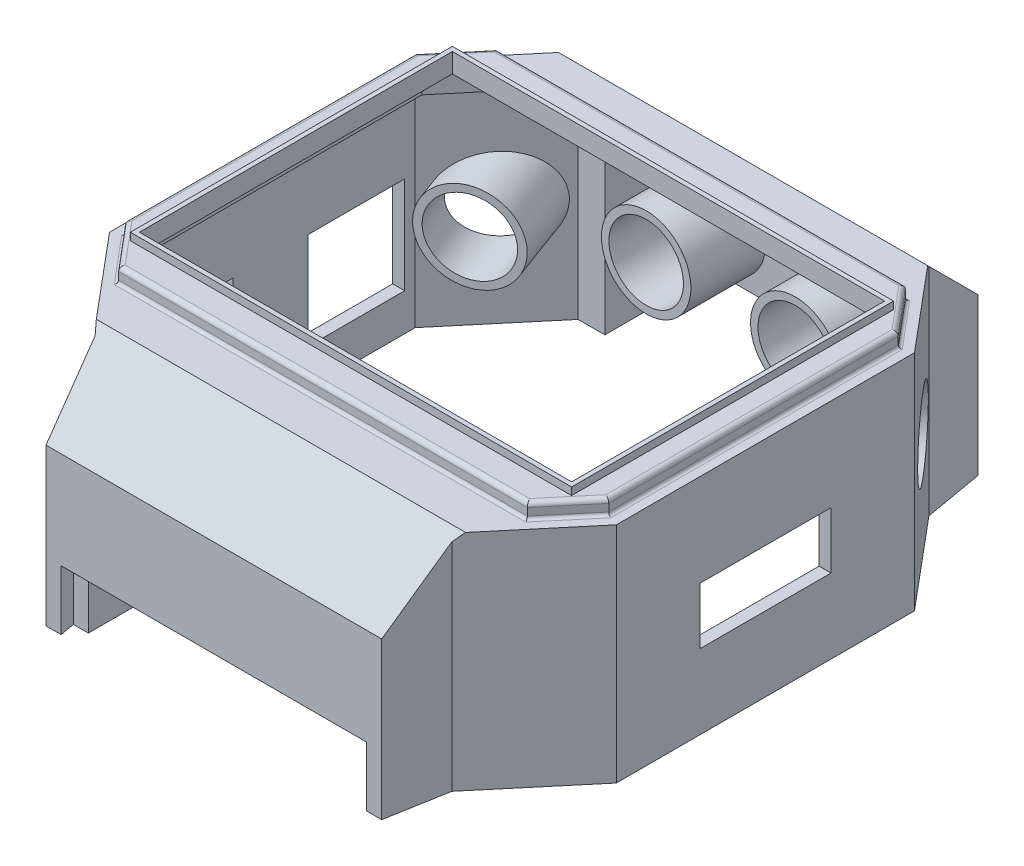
SolidWorks part; units mm, degrees
ref_plane "前视基准面" through (0, 0, 0) normal (0, 0, 1) x (1, 0, 0)
ref_plane "上视基准面" through (0, 0, 0) normal (0, 1, 0) x (1, 0, 0)
ref_plane "右视基准面" through (0, 0, 0) normal (1, 0, 0) x (0, 0, -1)
sketch "草图1" plane through (0, 0, 0) normal (0, 1, 0) x (1, 0, 0)
  line L0 (-11.2601, 20) -> (-11.9654, 16)
  line L1 (-11.2601, 20) -> (11.2601, 20)
  line L2 (-17, 10) -> (-17, -10)
  line L3 (-11.2601, -20) -> (11.2601, -20)
  line L4 (17, 10) -> (17, -10)
  line L5 (-12.7774, 15.0323) -> (12.7774, -15.0323) construction
  line L6 (-12.7774, -15.0323) -> (12.7774, 15.0323) construction
  line L7 (-11.9654, 16) -> (-17, 10)
  line L8 (11.2601, 20) -> (11.9654, 16)
  line L9 (11.9654, 16) -> (17, 10)
  line L10 (11.2601, -20) -> (11.9654, -16)
  line L11 (11.9654, -16) -> (17, -10)
  line L12 (-11.2601, -20) -> (-11.9654, -16)
  line L13 (-11.9654, -16) -> (-17, -10)
  point P0 (0, 0)
  dimension "D2" = 20
  dimension "D3" = 80
  dimension "D4" = 80
  dimension "D5" = 80
  dimension "D6" = 80
  dimension "D7" = 130
  dimension "D8" = 130
  dimension "D9" = 130
  dimension "D10" = 130
  dimension "D11" = 4
  dimension "D12" = 6
  dimension "D13" = 4
  dimension "D14" = 6
  dimension "D15" = 4
  dimension "D16" = 6
  dimension "D17" = 4
  dimension "D18" = 6
  dimension "D19" = 22.5202
extrude "凸台-拉伸1" add sketch "草图1" along normal blind 17
sketch "草图2" plane through (0, 17, 0) normal (0, 1, 0) x (1, 0, 0)
  line L1 (-14.5, 10.5) -> (14.5, 10.5)
  line L2 (-14.5, 10.5) -> (-14.5, -10.5)
  line L3 (-14.5, -10.5) -> (14.5, -10.5)
  line L4 (14.5, 10.5) -> (14.5, -10.5)
  line L7 (-14.5, 10.5) -> (14.5, -10.5) construction
  line L8 (-14.5, -10.5) -> (14.5, 10.5) construction
  point P0 (0, 0)
  dimension "D1" = 29
  dimension "D2" = 21
sketch "草图3" plane through (0, 17, 0) normal (0, 1, 0) x (1, 0, 0)
  line L0 (-11.2601, 20) -> (11.2601, 20)
  line L1 (11.2601, 20) -> (11.9654, 16)
  line L2 (11.9654, 16) -> (17, 10)
  line L3 (17, 10) -> (17, -10)
  line L4 (17, -10) -> (11.9654, -16)
  line L5 (11.9654, -16) -> (11.2601, -20)
  line L6 (11.2601, -20) -> (-11.2601, -20)
  line L7 (-11.2601, -20) -> (-11.9654, -16)
  line L8 (-11.9654, -16) -> (-17, -10)
  line L9 (-17, -10) -> (-17, 10)
  line L10 (-17, 10) -> (-11.9654, 16)
  line L11 (-11.9654, 16) -> (-11.2601, 20)
  line L12 (-14.5, 10.5) -> (14.5, 10.5) construction
  line L13 (14.5, 10.5) -> (14.5, -10.5) construction
  line L14 (14.5, -10.5) -> (-14.5, -10.5) construction
  line L15 (-14.5, -10.5) -> (-14.5, 10.5) construction
  line L16 (-14.8, 10.8) -> (14.8, 10.8)
  line L17 (14.8, 10.8) -> (14.8, -10.8)
  line L18 (14.8, -10.8) -> (-14.8, -10.8)
  line L19 (-14.8, -10.8) -> (-14.8, 10.8)
  dimension "D1" = 0.3
extrude "切除-拉伸3" cut sketch "草图3" against normal blind 1
sketch "草图5" plane through (0, 16, 0) normal (0, 1, 0) x (1, 0, 0)
  line L0 (-11.2601, 20) -> (11.2601, 20)
  line L1 (11.2601, 20) -> (11.9654, 16)
  line L2 (11.9654, 16) -> (17, 10)
  line L3 (17, 10) -> (17, -10)
  line L4 (17, -10) -> (11.9654, -16)
  line L5 (11.9654, -16) -> (11.2601, -20)
  line L6 (11.2601, -20) -> (-11.2601, -20)
  line L7 (-11.2601, -20) -> (-11.9654, -16)
  line L8 (-11.9654, -16) -> (-17, -10)
  line L9 (-17, -10) -> (-17, 10)
  line L10 (-17, 10) -> (-11.9654, 16)
  line L11 (-11.9654, 16) -> (-11.2601, 20)
  line L12 (11.2148, 15.65) -> (16.2, 9.7088) construction
  line L14 (13.7074, 12.6794) -> (16.2, 9.7088)
  line L15 (16.2, 9.7088) -> (16.2, -9.7088)
  line L16 (16.2, -9.7088) -> (13.7074, -12.6794)
  line L17 (16.2, -9.7088) -> (11.2148, -15.65) construction
  line L18 (11.2148, -15.65) -> (10.5888, -19.2) construction
  line L19 (-11.2148, 15.65) -> (-10.5888, 19.2) construction
  line L20 (-13.7074, -12.6794) -> (-16.2, -9.7088)
  line L21 (-16.2, -9.7088) -> (-16.2, 9.7088)
  line L22 (-16.2, 9.7088) -> (-13.7074, 12.6794)
  line L24 (-13.7074, -12.6794) -> (13.7074, -12.6794)
  line L25 (-13.7074, 12.6794) -> (13.7074, 12.6794)
  line L26 (-11.2148, -15.65) -> (-16.2, -9.7088) construction
  line L27 (-10.5888, -19.2) -> (-11.2148, -15.65) construction
  line L28 (10.5888, -19.2) -> (-10.5888, -19.2) construction
  line L29 (-16.2, 9.7088) -> (-11.2148, 15.65) construction
  line L30 (-10.5888, 19.2) -> (10.5888, 19.2) construction
  line L31 (10.5888, 19.2) -> (11.2148, 15.65) construction
  dimension "D1" = 0.8
extrude "切除-拉伸4" cut sketch "草图5" against normal blind 1
fillet "圆角5" radius 0.3 8 edges at (-14.9537, 16, 11.1941) (-16.2, 16, 0) (-14.9537, 16, -11.1941) (0, 16, -12.6794) (14.9537, 16, -11.1941) (16.2, 16, 0) (14.9537, 16, 11.1941) (0, 16, 12.6794)
fillet "圆角6" radius 0.2 8 edges at (-14.9537, 15, 11.1941) (-16.2, 15, 0) (-14.9537, 15, -11.1941) (0, 15, -12.6794) (14.9537, 15, -11.1941) (16.2, 15, 0) (14.9537, 15, 11.1941) (0, 15, 12.6794)
sketch "草图6" plane through (17, 0, 0) normal (1, 0, 0) x (0, 0, -1)
  line L0 (-15.5, 15) -> (-20, 10.5)
  line L3 (15.5, 15) -> (20, 10.5)
  line L6 (-16, 15) -> (-10, 15) construction
  line L7 (-20, 15) -> (-20, 0) construction
  line L8 (10, 15) -> (16, 15) construction
  line L9 (20, 15) -> (20, 0) construction
  line L10 (-15.5, 15) -> (-20, 15)
  line L11 (-20, 15) -> (-20, 10.5)
  line L12 (20, 10.5) -> (20, 15)
  line L13 (20, 15) -> (15.5, 15)
  point P13 (13, 15)
  point P14 (-13, 15)
  dimension "D1" = 2.5
  dimension "D2" = 45
  dimension "D3" = 45
  dimension "D4" = 2.5
extrude "切除-拉伸5" cut sketch "草图6" against normal up to next
sketch "草图7" plane through (0, 17, 0) normal (0, 1, 0) x (1, 0, 0)
  line L0 (-14.5, 10.5) -> (14.5, 10.5) construction
  line L1 (-14.5, 10.5) -> (-14.5, -10.5) construction
  line L2 (-14.5, -10.5) -> (14.5, -10.5) construction
  line L3 (14.5, 10.5) -> (14.5, -10.5) construction
  line L4 (-14.5, 10.5) -> (14.5, 10.5)
  line L5 (-14.5, 10.5) -> (-14.5, -10.5)
  line L6 (-14.5, -10.5) -> (14.5, -10.5)
  line L7 (14.5, 10.5) -> (14.5, -10.5)
extrude "切除-拉伸6" cut sketch "草图7" against normal up to next
sketch "草图8" plane through (0, 0, 0) normal (0, -1, 0) x (1, 0, 0)
  line L78 (10.9524, -17.138) -> (-10.9524, -17.138)
  line L79 (10.9691, 17.0434) -> (-10.9691, 17.0434)
  line L90 (10.5888, -19.2) -> (11.2148, -15.65)
  line L91 (11.2148, -15.65) -> (16.2, -9.7088)
  line L92 (16.2, -9.7088) -> (16.2, 9.7088)
  line L93 (16.2, 9.7088) -> (11.2148, 15.65)
  line L94 (11.2148, 15.65) -> (10.5888, 19.2)
  line L95 (10.5888, 19.2) -> (-10.5888, 19.2)
  line L96 (-10.5888, 19.2) -> (-11.2148, 15.65)
  line L97 (-11.2148, 15.65) -> (-16.2, 9.7088)
  line L98 (-16.2, 9.7088) -> (-16.2, -9.7088)
  line L99 (-16.2, -9.7088) -> (-11.2148, -15.65)
  line L100 (-11.2148, -15.65) -> (-10.5888, -19.2)
  line L101 (-10.5888, -19.2) -> (10.5888, -19.2)
  line L102 (10.9524, -17.138) -> (11.2148, -15.65)
  line L103 (11.2148, -15.65) -> (16.2, -9.7088)
  line L104 (16.2, -9.7088) -> (16.2, 9.7088)
  line L105 (16.2, 9.7088) -> (11.2148, 15.65)
  line L106 (11.2148, 15.65) -> (10.9691, 17.0434)
  line L108 (-10.9691, 17.0434) -> (-11.2148, 15.65)
  line L109 (-11.2148, 15.65) -> (-16.2, 9.7088)
  line L110 (-16.2, 9.7088) -> (-16.2, -9.7088)
  line L111 (-16.2, -9.7088) -> (-11.2148, -15.65)
  line L112 (-11.2148, -15.65) -> (-10.9524, -17.138)
  dimension "D1" = 0.8
extrude "切除-拉伸7" cut sketch "草图8" against normal offset from surface (12.5 mm away) 2.5
sketch "草图9" plane through (0, 12.5, 0) normal (0, -1, 0) x (1, 0, 0)
  line L0 (-12.385, 15.5) -> (12.385, 15.5) construction
  line L1 (-11.2148, 15.65) -> (-16.2, 9.7088) construction
  line L2 (11.2148, 15.65) -> (16.2, 9.7088) construction
  line L3 (16.2, 9.7088) -> (16.2, -9.7088) construction
  line L4 (-12.385, -15.5) -> (12.385, -15.5) construction
  line L5 (16.2, -9.7088) -> (11.2148, -15.65) construction
  line L6 (-11.2148, -15.65) -> (-16.2, -9.7088) construction
  line L7 (-11.2412, 15.5) -> (11.2412, 15.5)
  line L8 (-11.2148, 15.65) -> (-16.2, 9.7088)
  line L9 (11.2148, 15.65) -> (16.2, 9.7088)
  line L10 (16.2, 9.7088) -> (16.2, -9.7088)
  line L11 (-11.2412, -15.5) -> (11.2412, -15.5)
  line L12 (16.2, -9.7088) -> (11.2148, -15.65)
  line L13 (-11.2148, -15.65) -> (-16.2, -9.7088)
  line L14 (-16.2, 9.7088) -> (-16.2, -9.7088)
  line L15 (11.2148, 15.65) -> (11.2412, 15.5)
  line L16 (11.2148, 15.65) -> (10.9691, 17.0434) construction
  line L17 (-11.2148, 15.65) -> (-11.2412, 15.5)
  line L18 (-11.2148, 15.65) -> (-10.9691, 17.0434) construction
  line L19 (11.2148, -15.65) -> (11.2412, -15.5)
  line L20 (11.2148, -15.65) -> (10.9524, -17.138) construction
  line L21 (-11.2148, -15.65) -> (-11.2412, -15.5)
  line L22 (-10.9524, -17.138) -> (-11.2148, -15.65) construction
extrude "切除-拉伸8" cut sketch "草图9" against normal offset from surface (1.5 mm away) 1
sketch "草图11" plane through (0, 14, 0) normal (0, -1, 0) x (1, 0, 0)
  line L0 (-13.7074, 12.6794) -> (13.7074, 12.6794) construction
  line L1 (13.7074, 12.6794) -> (16.2, 9.7088) construction
  line L2 (16.2, 9.7088) -> (16.2, -9.7088) construction
  line L3 (16.2, -9.7088) -> (13.7074, -12.6794) construction
  line L4 (13.7074, -12.6794) -> (-13.7074, -12.6794) construction
  line L5 (-13.7074, -12.6794) -> (-16.2, -9.7088) construction
  line L6 (-16.2, -9.7088) -> (-16.2, 9.7088) construction
  line L7 (-16.2, 9.7088) -> (-13.7074, 12.6794) construction
  line L8 (-13.7074, 12.6794) -> (13.7074, 12.6794) construction
  line L9 (13.7074, 12.6794) -> (16.2, 9.7088) construction
  line L10 (16.2, 9.7088) -> (16.2, -9.7088) construction
  line L11 (16.2, -9.7088) -> (13.7074, -12.6794) construction
  line L12 (13.7074, -12.6794) -> (-13.7074, -12.6794) construction
  line L13 (-13.7074, -12.6794) -> (-16.2, -9.7088) construction
  line L14 (-16.2, -9.7088) -> (-16.2, 9.7088) construction
  line L15 (-16.2, 9.7088) -> (-13.7074, 12.6794) construction
  line L16 (-13.381, 11.9794) -> (13.381, 11.9794)
  line L17 (13.381, 11.9794) -> (15.5, 9.454)
  line L18 (15.5, 9.454) -> (15.5, -9.454)
  line L19 (15.5, -9.454) -> (13.381, -11.9794)
  line L20 (13.381, -11.9794) -> (-13.381, -11.9794)
  line L21 (-13.381, -11.9794) -> (-15.5, -9.454)
  line L22 (-15.5, -9.454) -> (-15.5, 9.454)
  line L23 (-15.5, 9.454) -> (-13.381, 11.9794)
  dimension "D1" = 0.7
extrude "切除-拉伸9" cut sketch "草图11" against normal offset from surface (1.2 mm away) 0.8
sketch "草图12" plane through (0, 12.5, 0) normal (0, -1, 0) x (1, 0, 0)
  line L0 (-11.2148, -15.65) -> (-10.9524, -17.138)
  line L1 (11.2148, 15.65) -> (10.9691, 17.0434)
  line L2 (10.9691, 17.0434) -> (-10.9691, 17.0434)
  line L3 (-10.9691, 17.0434) -> (-11.2148, 15.65)
  line L4 (11.2148, 15.65) -> (-11.2148, 15.65)
  line L5 (-10.9524, -17.138) -> (10.9524, -17.138)
  line L6 (10.9524, -17.138) -> (11.2148, -15.65)
  line L7 (11.2148, -15.65) -> (-11.2148, -15.65)
extrude "凸台-拉伸2" add sketch "草图12" along normal up to surface (12.5 mm away)
sketch "草图13" plane through (0, 0, 0) normal (0, -1, 0) x (1, 0, 0)
  line L4 (-10.2447, 20) -> (10.2447, 20)
  line L5 (-10.2447, 20) -> (-10.8354, 16.65)
  line L6 (10.2447, 20) -> (10.8354, 16.65)
  line L8 (-10.8354, 16.65) -> (10.8354, 16.65)
extrude "切除-拉伸10" cut sketch "草图13" against normal blind 4
mirror "镜向1" about plane through (0, 0, 0) normal (0, 0, 1) of "切除-拉伸10"
sketch "草图15" plane through (0, 0, 0) normal (0, -1, 0) x (1, 0, 0)
  line L1 (-10.421, 19) -> (-11.2148, 15.65)
  line L2 (-10.421, 19) -> (10.421, 19)
  line L4 (-10.2447, 20) -> (-10.8354, 16.65) construction
  line L5 (-11.2148, 15.65) -> (11.2148, 15.65)
  line L6 (11.2148, 15.65) -> (10.421, 19)
  line L7 (10.8354, 16.65) -> (10.2447, 20) construction
extrude "切除-拉伸13" cut sketch "草图15" against normal up to vertex (9.3787 mm away)
mirror "镜向2" about plane through (0, 0, 0) normal (0, 0, 1) of "切除-拉伸13"
sketch "草图16" plane through (0, 12.5, 0) normal (0, -1, 0) x (1, 0, 0)
  line L0 (-11.2148, 15.65) -> (-11.2412, 15.5)
  line L1 (-11.2412, 15.5) -> (11.2412, 15.5)
  line L2 (11.2412, 15.5) -> (11.2148, 15.65)
  line L3 (11.2148, 15.65) -> (-11.2148, 15.65)
  line L4 (-11.2412, -15.5) -> (-11.2148, -15.65)
  line L5 (-11.2148, -15.65) -> (11.2148, -15.65)
  line L6 (11.2148, -15.65) -> (11.2412, -15.5)
  line L7 (11.2412, -15.5) -> (-11.2412, -15.5)
extrude "切除-拉伸14" cut sketch "草图16" against normal up to surface (1.5 mm away)
sketch "草图18" plane through (0, 17, 0) normal (0, 1, 0) x (1, 0, 0)
  line L0 (-14.8, 10.8) -> (14.8, 10.8)
  line L1 (14.8, 10.8) -> (14.8, -10.8)
  line L2 (14.8, -10.8) -> (-14.8, -10.8)
  line L3 (-14.8, -10.8) -> (-14.8, 10.8)
extrude "切除-拉伸15" cut sketch "草图18" against normal blind 0.5
sketch "草图19" plane through (0, 10.5, 0) normal (0, -1, 0) x (1, 0, 0)
  line L0 (-9.421, 19) -> (-10.421, 19)
  line L1 (10.421, 19) -> (-10.421, 19) construction
  line L2 (-10.421, 19) -> (-11.2148, 15.65)
  line L3 (-11.2148, 15.65) -> (-9.421, 15.65)
  line L5 (-11.2148, 15.65) -> (11.2148, 15.65) construction
  line L6 (-9.421, 15.65) -> (-9.421, 19)
  line L7 (11.2148, 15.65) -> (10.421, 19)
  line L8 (10.421, 19) -> (9.421, 19)
  line L9 (9.421, 19) -> (9.421, 15.65)
  line L10 (9.421, 15.65) -> (11.2148, 15.65)
  dimension "D1" = 1
  dimension "D2" = 1
extrude "凸台-拉伸3" add sketch "草图19" along normal up to surface (10.5 mm away)
mirror "镜向3" about plane through (0, 0, 0) normal (0, 0, 1) of "凸台-拉伸3"
sketch "草图20" plane through (-17, 0, 0) normal (-1, 0, 0) x (0, 0, 1)
  line L0 (-10, 15) -> (-10, 0) construction
  line L1 (-9, 9) -> (-2.5, 9)
  line L2 (-9, 9) -> (-9, 2.5)
  line L3 (-9, 2.5) -> (-2.5, 2.5)
  line L4 (-2.5, 9) -> (-2.5, 2.5)
  line L5 (-9, 9) -> (-2.5, 2.5) construction
  line L6 (-9, 2.5) -> (-2.5, 9) construction
  line L7 (2.5, 9) -> (9, 9)
  line L8 (2.5, 9) -> (2.5, 2.5)
  line L9 (2.5, 2.5) -> (9, 2.5)
  line L10 (9, 9) -> (9, 2.5)
  line L11 (2.5, 9) -> (9, 2.5) construction
  line L12 (2.5, 2.5) -> (9, 9) construction
  line L13 (10, 15) -> (10, 0) construction
  line L14 (-10, 0) -> (10, 0) construction
  point P0 (-5.75, 5.75)
  point P5 (5.75, 5.75)
  dimension "D1" = 6.5
  dimension "D2" = 6.5
  dimension "D3" = 6.5
  dimension "D4" = 6.5
  dimension "D5" = 1
  dimension "D6" = 1
  dimension "D7" = 2.5
  dimension "D8" = 2.5
extrude "切除-拉伸16" cut sketch "草图20" against normal up to next
sketch "草图21" plane through (17, 0, 0) normal (1, 0, 0) x (0, 0, -1)
  line L0 (-10, 0) -> (10, 0) construction
  line L1 (-4.4, 8.8) -> (4.4, 8.8)
  line L2 (-4.4, 8.8) -> (-4.4, 5)
  line L3 (-4.4, 5) -> (4.4, 5)
  line L4 (4.4, 8.8) -> (4.4, 5)
  line L5 (-4.4, 8.8) -> (4.4, 5) construction
  line L6 (-4.4, 5) -> (4.4, 8.8) construction
  point P0 (0, 6.9)
  dimension "D1" = 8.8
  dimension "D2" = 3.8
  dimension "D3" = 5
extrude "切除-拉伸17" cut sketch "草图21" against normal up to next
sketch "草图24" plane through (0, 0, -20) normal (0, 0, -1) x (-1, 0, 0)
  line L0 (0, 10.5) -> (0, 4) construction
  line L1 (11.2601, 10.5) -> (-11.2601, 10.5) construction
  line L2 (-10.2447, 4) -> (10.2447, 4) construction
  circle A1 centre (-5, 7.25) radius 3
  circle A2 centre (5, 7.25) radius 3
  dimension "D1" = 6
  dimension "D2" = 5
  dimension "D3" = 5
extrude "凸台-拉伸4" add sketch "草图24" against normal blind 6
sketch "草图25" plane through (0, 0, -20) normal (0, 0, -1) x (-1, 0, 0)
  circle A0 centre (-5, 7.25) radius 3 construction
  circle A2 centre (5, 7.25) radius 3 construction
  circle A3 centre (-5, 7.25) radius 3 construction
  circle A5 centre (5, 7.25) radius 3 construction
  circle A6 centre (-5, 7.25) radius 2.5
  circle A8 centre (5, 7.25) radius 2.5
  dimension "D1" = 5
extrude "切除-拉伸18" cut sketch "草图25" against normal up to next
ref_plane "基准面1" through (-5.8736, 0.1867, -16.1323) normal (0.3421, -0.0109, 0.9396) x (-0.014, 0.9998, 0.0167)
sketch "草图26" plane through (-5.8736, 0.1867, -16.1323) normal (0.3421, -0.0109, 0.9396) x (-0.014, 0.9998, 0.0167)
  line L0 (14.0614, 11.6381) -> (0.0647, 11.9018) construction
  line L1 (0.0647, 11.9018) -> (-0.104, 5.1868) construction
  line L2 (13.8927, 4.9231) -> (-0.104, 5.1868) construction
  line L3 (13.8927, 4.9231) -> (14.0614, 11.6381) construction
  line L4 (14.0614, 11.6381) -> (0.0647, 11.9018) construction
  line L5 (0.0647, 11.9018) -> (-0.104, 5.1868) construction
  line L6 (13.8927, 4.9231) -> (-0.104, 5.1868) construction
  line L7 (13.8927, 4.9231) -> (14.0614, 11.6381) construction
  line L8 (13.9771, 8.2806) -> (-0.0196, 8.5443) construction
  line L9 (7.0631, 11.7699) -> (6.8944, 5.055) construction
  circle A0 centre (6.9787, 8.4124) radius 3
  point P8 (6.9787, 8.4124)
  dimension "D1" = 6
ref_plane "基准面2" through (-4.6762, 0.1487, -12.8437) normal (0.3421, -0.0109, 0.9396) x (-0.014, 0.9998, 0.0167)
sketch "草图27" plane through (-4.6762, 0.1487, -12.8437) normal (0.3421, -0.0109, 0.9396) x (-0.014, 0.9998, 0.0167)
  circle A0 centre (6.9787, 8.4124) radius 3 construction
  circle A1 centre (6.9787, 8.4124) radius 3
extrude "凸台-拉伸5" add sketch "草图27" against normal up to surface (4.7414 mm away)
sketch "草图29" plane through (-5.8736, 0.1867, -16.1323) normal (0.3421, -0.0109, 0.9396) x (-0.014, 0.9998, 0.0167)
  circle A0 centre (6.9787, 8.4124) radius 3 construction
  circle A1 centre (6.9787, 8.4124) radius 3 construction
sketch "草图30" plane through (-4.6762, 0.1487, -12.8437) normal (0.3421, -0.0109, 0.9396) x (-0.014, 0.9998, 0.0167)
  circle A0 centre (6.9787, 8.4124) radius 3 construction
  circle A1 centre (6.9787, 8.4124) radius 3 construction
  circle A2 centre (6.9787, 8.4124) radius 2.5
  dimension "D1" = 5
extrude "切除-拉伸19" cut sketch "草图30" against normal up to next
mirror "镜向4" about plane through (0, 0, 0) normal (1, 0, 0) of "切除-拉伸19"
ref_plane "基准面3" through (5.8736, 0.1867, -16.1323) normal (0.3421, 0.0109, -0.9396) x (0.014, 0.9998, 0.0167)
ref_plane "基准面4" through (4.6762, 0.1487, -12.8437) normal (0.3421, 0.0109, -0.9396) x (0.014, 0.9998, 0.0167)
sketch "草图31" plane through (4.6762, 0.1487, -12.8437) normal (0.3421, 0.0109, -0.9396) x (0.014, 0.9998, 0.0167)
  circle A0 centre (6.9787, 8.4124) radius 2.5 construction
  circle A1 centre (6.9787, 8.4124) radius 2.5
  circle A2 centre (6.9787, 8.4124) radius 3
  dimension "D1" = 6
extrude "凸台-拉伸6" add sketch "草图31" along normal up to next
